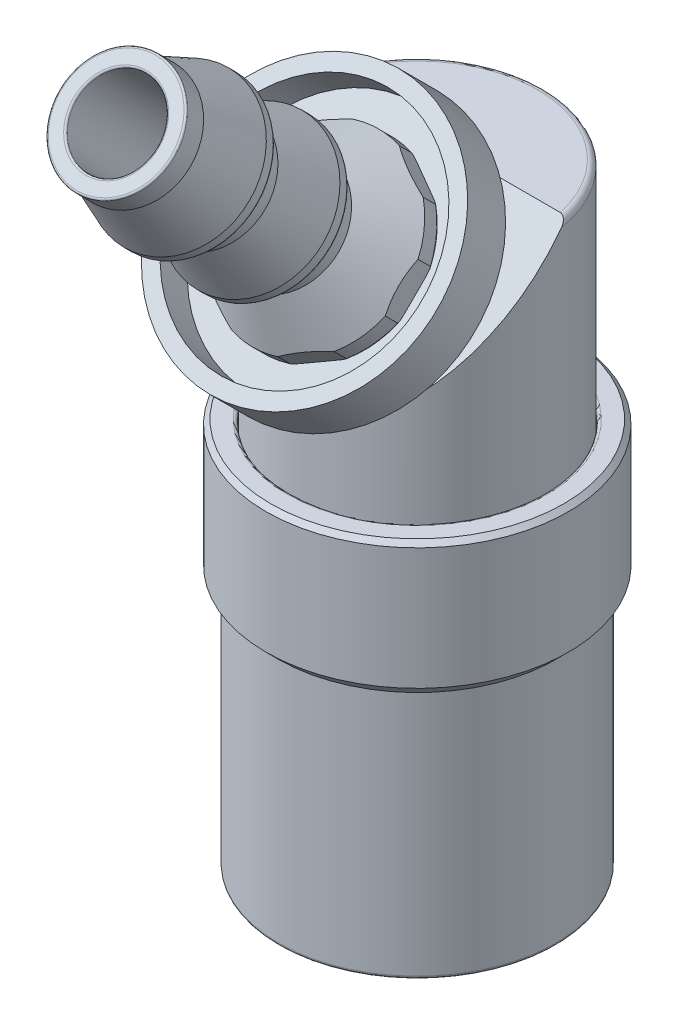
SolidWorks part; units mm, degrees
other "BODY_"
ref_plane "Front Plane" through (0, 0, 0) normal (0, 0, 1) x (1, 0, 0)
ref_plane "Top Plane" through (0, 0, 0) normal (0, 1, 0) x (1, 0, 0)
ref_plane "Right Plane" through (0, 0, 0) normal (1, 0, 0) x (0, 0, -1)
imported_body "PL-BARB"
imported_body "BARB"
imported_body "SC200S"
imported_body "BODY"
imported_body "SLEEVE"
sketch "Sketch1" plane through (0, 0, 0) normal (0, 0, 1) x (1, 0, 0)
  line L0 (-6.7437, 1.016) -> (-4.7625, 2.9972)
  line L1 (-4.7625, 2.9972) -> (-4.7625, 11.1863)
  line L2 (-4.7625, 11.1863) -> (-6.7437, 13.0794)
  line L3 (-6.7437, 13.0794) -> (-6.7437, 1.016)
  line L4 (-6.7437, 1.016) -> (-7.7597, 0) construction
  line L5 (-7.0834, 13.404) -> (-6.7437, 13.0794) construction
  line L6 (0, 8.7926) -> (0, -2.6506) construction
  line L7 (0, 13.0794) -> (0, 1.016) construction
  dimension "D1" = 9.525
revolve "Revolve1" add sketch "Sketch1" angle 360 about L6
sketch "Sketch2" plane through (0, 0, 0) normal (0, -1, 0) x (1, 0, 0)
  line L1 (6.477, -3.7395) -> (6.477, 3.7395)
  line L2 (6.477, 3.7395) -> (0, 7.479)
  line L3 (0, 7.479) -> (-6.477, 3.7395)
  line L4 (-6.477, 3.7395) -> (-6.477, -3.7395)
  line L5 (-6.477, -3.7395) -> (0, -7.479)
  line L6 (0, -7.479) -> (6.477, -3.7395)
  circle A0 centre (0, 0) radius 6.477 construction
  dimension "D1" = 12.954
extrude "Cut-Extrude1" cut sketch "Sketch2" against normal up to surface (15.5119 mm away)
